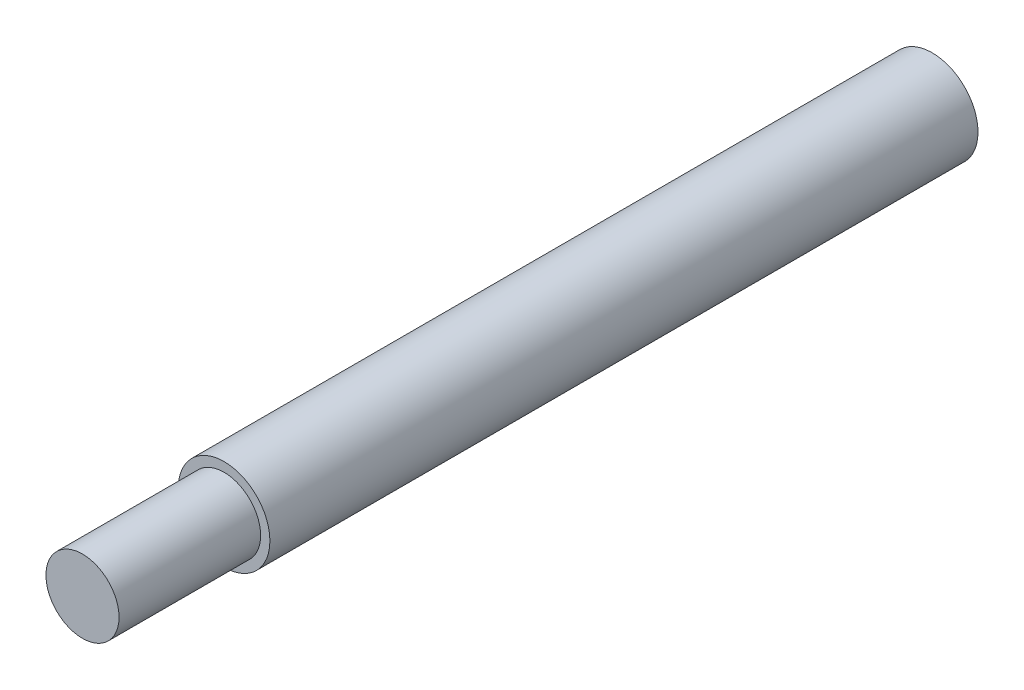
SolidWorks part; units mm, degrees
ref_plane "Front" through (0, 0, 0) normal (0, 0, 1) x (1, 0, 0)
ref_plane "Top" through (0, 0, 0) normal (0, 1, 0) x (1, 0, 0)
ref_plane "Right" through (0, 0, 0) normal (1, 0, 0) x (0, 0, -1)
sketch "Sketch1" plane through (0, 0, 0) normal (0, 0, 1) x (1, 0, 0)
  circle A0 centre (0, 0) radius 10.025
  dimension "D1" = 20.05
extrude "Boss-Extrude1" add sketch "Sketch1" along normal blind 155
sketch "Sketch2" plane through (0, 0, 155) normal (0, 0, 1) x (1, 0, 0)
  circle A0 centre (0, 0) radius 8
  dimension "D1" = 16
extrude "Boss-Extrude2" add sketch "Sketch2" along normal blind 31
